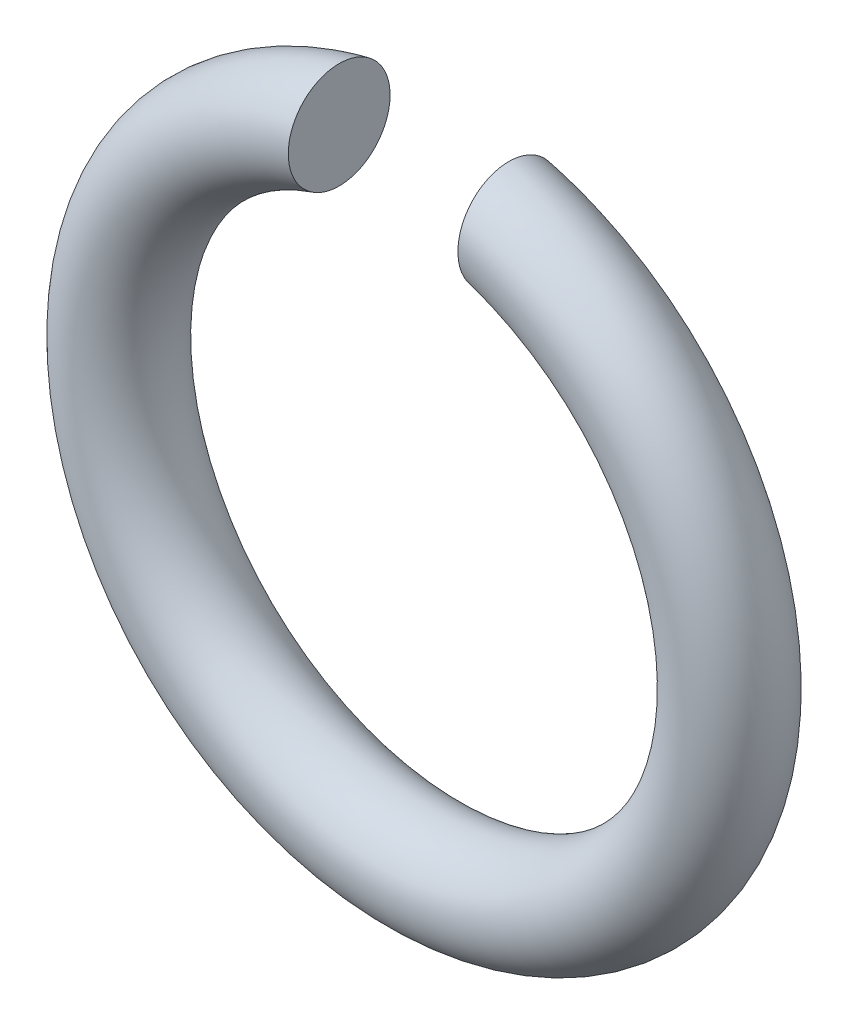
SolidWorks part; units mm, degrees
ref_plane "Front" through (0, 0, 0) normal (0, 0, 1) x (1, 0, 0)
ref_plane "Top" through (0, 0, 0) normal (0, 1, 0) x (1, 0, 0)
ref_plane "Right" through (0, 0, 0) normal (1, 0, 0) x (0, 0, -1)
sketch "Sketch1" plane through (0, 0, 0) normal (0, 0, 1) x (1, 0, 0)
  circle A1 centre (0, 0) radius 1.8
  dimension "D1" = 3.6
sketch "Sketch2" plane through (0, 0, 0) normal (0, 1, 0) x (1, 0, 0)
  circle A0 centre (1.8, 0) radius 0.3
  dimension "d1" = 0.6
sweep "Base-Sweep" add profiles "Sketch2" path "Sketch1"
sketch "Sketch3" plane through (0, 0, 0) normal (0, 0, 1) x (1, 0, 0)
  line L1 (-0.5, 0) -> (0.5, 0)
  line L2 (-0.5, 0) -> (-0.5, 2.1)
  line L3 (-0.5, 2.1) -> (0.5, 2.1)
  line L4 (0.5, 0) -> (0.5, 2.1)
  dimension "B" = 1
  dimension "B/2" = 0.5
  dimension "D3" = 2.1
extrude "Cut-Extrude1" cut sketch "Sketch3" against normal through all and the other way through all
equation "\"B/2@Sketch3\" = \"B@Sketch3\" / 2"
